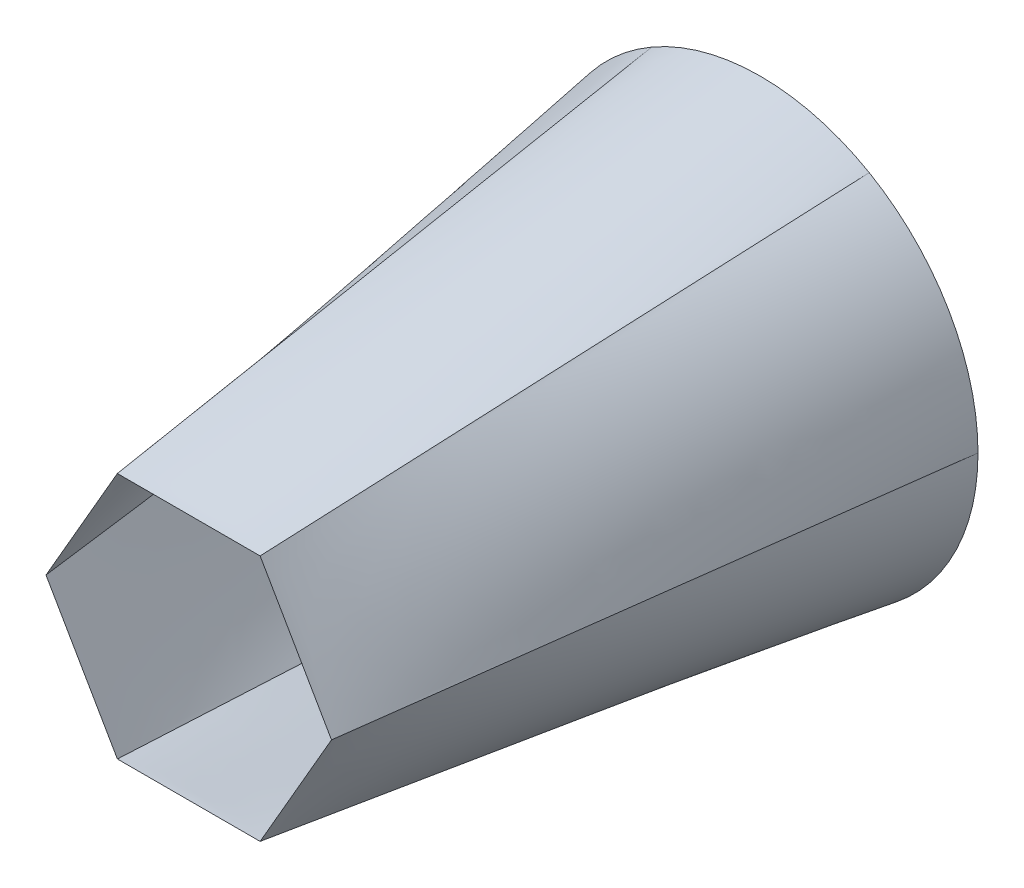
SolidWorks part; units mm, degrees
ref_plane "Front" through (0, 0, 0) normal (0, 0, 1) x (1, 0, 0)
ref_plane "Top" through (0, 0, 0) normal (0, 1, 0) x (1, 0, 0)
ref_plane "Right" through (0, 0, 0) normal (1, 0, 0) x (0, 0, -1)
sketch "Sketch1" plane through (0, 0, 0) normal (0, 0, 1) x (1, 0, 0)
  line L1 (49.9329, 0) -> (24.9665, 43.2432)
  line L2 (24.9665, 43.2432) -> (-24.9665, 43.2432)
  line L3 (-24.9665, 43.2432) -> (-49.9329, 0)
  line L4 (-49.9329, 0) -> (-24.9665, -43.2432)
  line L5 (-24.9665, -43.2432) -> (24.9665, -43.2432)
  line L6 (24.9665, -43.2432) -> (49.9329, 0)
  circle A0 centre (0, 0) radius 43.2432 construction
ref_plane "Plane1" through (0, 0, -200) normal (0, 0, 1) x (1, 0, 0)
sketch "Sketch2" plane through (0, 0, -200) normal (0, 0, 1) x (1, 0, 0)
  circle A0 centre (0, 0) radius 76.0814
surface "Surface-Loft1"
